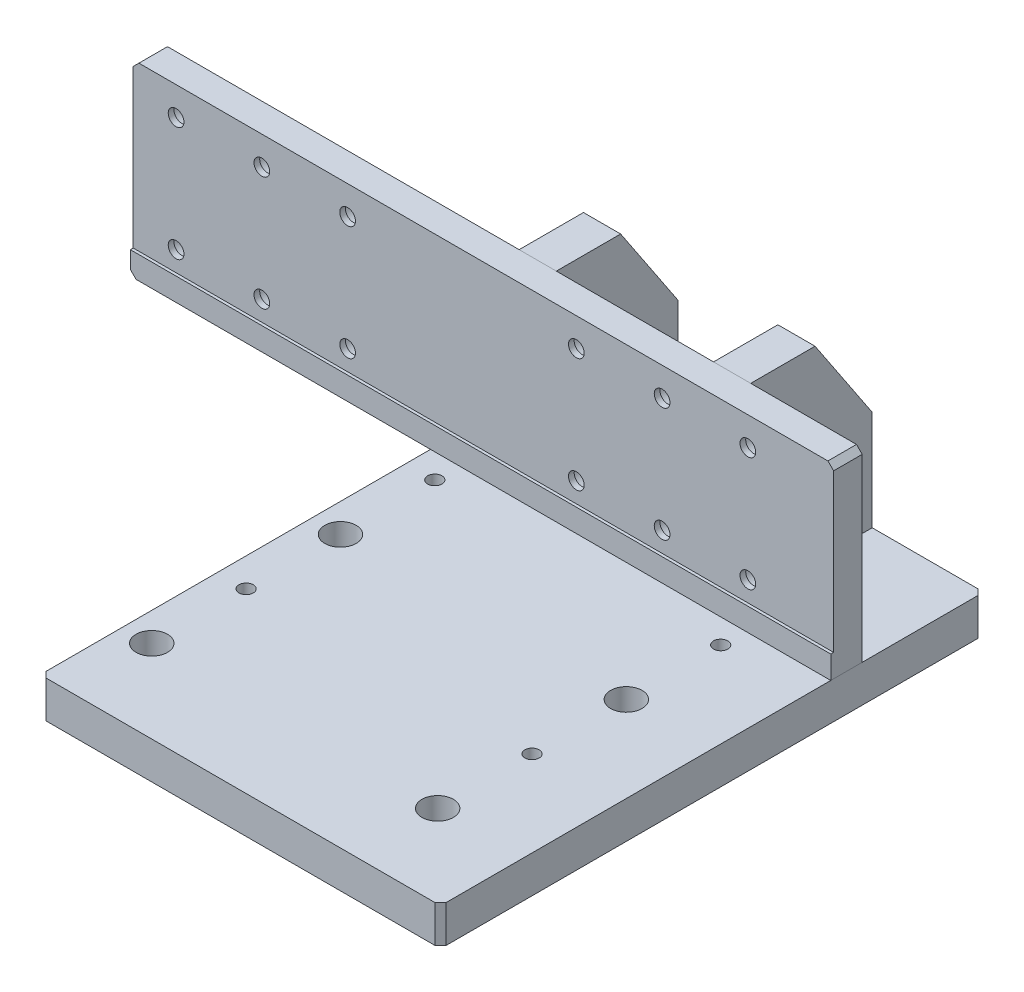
SolidWorks part; units mm, degrees
ref_plane "정면" through (0, 0, 0) normal (0, 0, 1) x (1, 0, 0)
ref_plane "윗면" through (0, 0, 0) normal (0, 1, 0) x (1, 0, 0)
ref_plane "우측면" through (0, 0, 0) normal (1, 0, 0) x (0, 0, -1)
sketch "스케치1" plane through (0, 0, 0) normal (0, 1, 0) x (1, 0, 0)
  line L1 (-70, 95) -> (70, 95)
  line L2 (-70, 95) -> (-70, -95)
  line L3 (-70, -95) -> (70, -95)
  line L4 (70, 95) -> (70, -95)
  line L5 (-70, 95) -> (70, -95) construction
  line L6 (-70, -95) -> (70, 95) construction
  point P0 (0, 0)
  dimension "D1" = 140
  dimension "D2" = 190
extrude "보스-돌출1" add sketch "스케치1" along normal blind 13
sketch "스케치2" plane through (0, 13, 0) normal (0, 1, 0) x (1, 0, 0)
  line L0 (70, -95) -> (70, 95) construction
  line L1 (70, 52.5) -> (-175, 52.5)
  line L2 (70, 52.5) -> (70, 41.5)
  line L3 (70, 41.5) -> (-175, 41.5)
  line L4 (-175, 52.5) -> (-175, 41.5)
  line L5 (70, 95) -> (-70, 95) construction
  dimension "D1" = 11
  dimension "D2" = 245
  dimension "D3" = 42.5
extrude "보스-돌출2" add sketch "스케치2" along normal blind 65 separate body
sketch "스케치3" plane through (0, 0, -41.5) normal (0, 0, 1) x (1, 0, 0)
  line L0 (70, 78) -> (70, 13) construction
  line L1 (-175, 78) -> (70, 78)
  line L2 (-175, 78) -> (-175, 21)
  line L3 (-175, 21) -> (70, 21)
  line L4 (70, 78) -> (70, 21)
  line L5 (-175, 13) -> (70, 13) construction
  dimension "D1" = 8
extrude "컷-돌출1" cut sketch "스케치3" against normal blind 1
sketch "스케치4" plane through (0, 13, 0) normal (0, 1, 0) x (1, 0, 0)
  line L0 (70, 95) -> (-70, 95) construction
  line L1 (-50, 95) -> (-37, 95)
  line L2 (-50, 95) -> (-50, 52.5)
  line L3 (-50, 52.5) -> (-37, 52.5)
  line L4 (-37, 95) -> (-37, 52.5)
  line L5 (70, 52.5) -> (-175, 52.5) construction
  line L6 (-70, 95) -> (-70, -95) construction
  line L7 (18, 95) -> (31, 95)
  line L8 (18, 95) -> (18, 52.5)
  line L9 (18, 52.5) -> (31, 52.5)
  line L10 (31, 95) -> (31, 52.5)
  dimension "D1" = 20
  dimension "D2" = 55
  dimension "D3" = 13
extrude "보스-돌출3" add sketch "스케치4" along normal blind 65 separate body
sketch "스케치5" plane through (-50, 0, 0) normal (-1, 0, 0) x (0, 0, 1)
  line L0 (-95, 78) -> (-95, 48)
  line L1 (-95, 78) -> (-95, 13) construction
  line L2 (-95, 48) -> (-75, 78)
  line L3 (-95, 78) -> (-52.5, 78) construction
  line L4 (-75, 78) -> (-95, 78)
  dimension "D1" = 20
  dimension "D2" = 30
extrude "컷-돌출2" cut sketch "스케치5" against normal through all
hole_wizard "M6 소켓 머리 캡 나사용 카운터보어1" positions "스케치6" profile "스케치7" counterbore size "M6" standard "KS"
sketch "스케치6" plane through (0, 13, 0) normal (0, 1, 0) x (1, 0, 0)
  line L1 (70, 95) -> (-70, 95) construction
  line L2 (-70, 95) -> (-70, -95) construction
  point P0 (-60, 66)
  point P2 (40, 66)
  point P24 (0, 0)
  point P25 (0, 0)
  point P26 (40, 0)
  point P27 (-60, 0)
  point P28 (-60, -66)
  point P29 (40, -66)
  dimension "D1" = 100
  dimension "D2" = 10
  dimension "D3" = 29
  dimension "D4" = 66
  dimension "D5" = 66
sketch "스케치7" plane through (-60, 13, -66) normal (1, 0, 0) x (0, 0, 1)
  line L0 (0, 0) -> (0, 13)
  line L1 (0, 13) -> (3.3, 13)
  line L3 (3.3, 13) -> (3.3, 8)
  line L4 (3.3, 8) -> (5.5, 8)
  line L5 (5.5, 8) -> (5.5, 0)
  line L7 (5.5, 0) -> (0, 0)
  line L11 (0, -6.35) -> (0, 107.95) construction
  dimension "관통 구멍 지름" = 6.6
  dimension "관통 구멍 깊이" = 13
  dimension "카운터보어 지름" = 11
  dimension "카운터보어 깊이" = 8
hole_wizard "Ø5.0mm 맞춤핀 구멍1" positions "스케치8" profile "스케치9" hole size "Ø5.0" standard "ISO"
sketch "스케치8" plane through (0, 13, 0) normal (0, 1, 0) x (1, 0, 0)
  line L0 (70, 95) -> (-70, 95) construction
  line L1 (-70, 95) -> (-70, -95) construction
  point P0 (-60, 33)
  point P2 (40, 33)
  point P4 (-60, -33)
  point P6 (40, -33)
  dimension "D1" = 100
  dimension "D2" = 62
  dimension "D3" = 66
  dimension "D4" = 10
sketch "스케치9" plane through (-60, 13, -33) normal (1, 0, 0) x (0, 0, 1)
  line L0 (0, 0) -> (0, 13)
  line L1 (0, 13) -> (2.5, 13)
  line L2 (2.5, 13) -> (2.5, 0)
  line L5 (2.5, 0) -> (0, 0)
  line L11 (0, -6.35) -> (0, 107.95) construction
  dimension "관통 구멍 지름" = 5
  dimension "관통 구멍 깊이" = 13
hole_wizard "M5 소켓 머리 캡 나사용 카운터보어1" positions "스케치10" profile "스케치11" counterbore size "M5" standard "KS"
sketch "스케치10" plane through (0, 0, -52.5) normal (0, 0, -1) x (-1, 0, 0)
  line L0 (-70, 13) -> (175, 13) construction
  line L1 (-70, 78) -> (-70, 13) construction
  point P0 (-40, 68)
  point P2 (-10, 68)
  point P4 (20, 68)
  point P6 (-40, 28)
  point P8 (-10, 28)
  point P10 (20, 28)
  dimension "D1" = 15
  dimension "D2" = 40
  dimension "D3" = 30
  dimension "D4" = 30
  dimension "D5" = 30
sketch "스케치11" plane through (40, 68, -52.5) normal (1, 0, 0) x (0, 1, 0)
  line L0 (0, 0) -> (0, 147.5)
  line L1 (0, 147.5) -> (2.75, 147.5)
  line L3 (2.75, 147.5) -> (2.75, 8)
  line L4 (2.75, 8) -> (4.75, 8)
  line L5 (4.75, 8) -> (4.75, 0)
  line L7 (4.75, 0) -> (0, 0)
  line L11 (0, -6.35) -> (0, 107.95) construction
  dimension "관통 구멍 지름" = 5.5
  dimension "관통 구멍 깊이" = 147.5
  dimension "카운터보어 지름" = 9.5
  dimension "카운터보어 깊이" = 8
pattern_linear "선형 패턴1" count 2 spacing 140 along (-1, 0, 0) of "M5 소켓 머리 캡 나사용 카운터보어1"
chamfer "모따기1" distance 2 angle 45 3 edges at (-175, 13, -47) (-175, 78, -47.5) (70, 78, -47.5)
chamfer "모따기2" distance 2 angle 45 4 edges at (70, 6.5, -95) (70, 6.5, 95) (-70, 6.5, -95) (-70, 6.5, 95)
